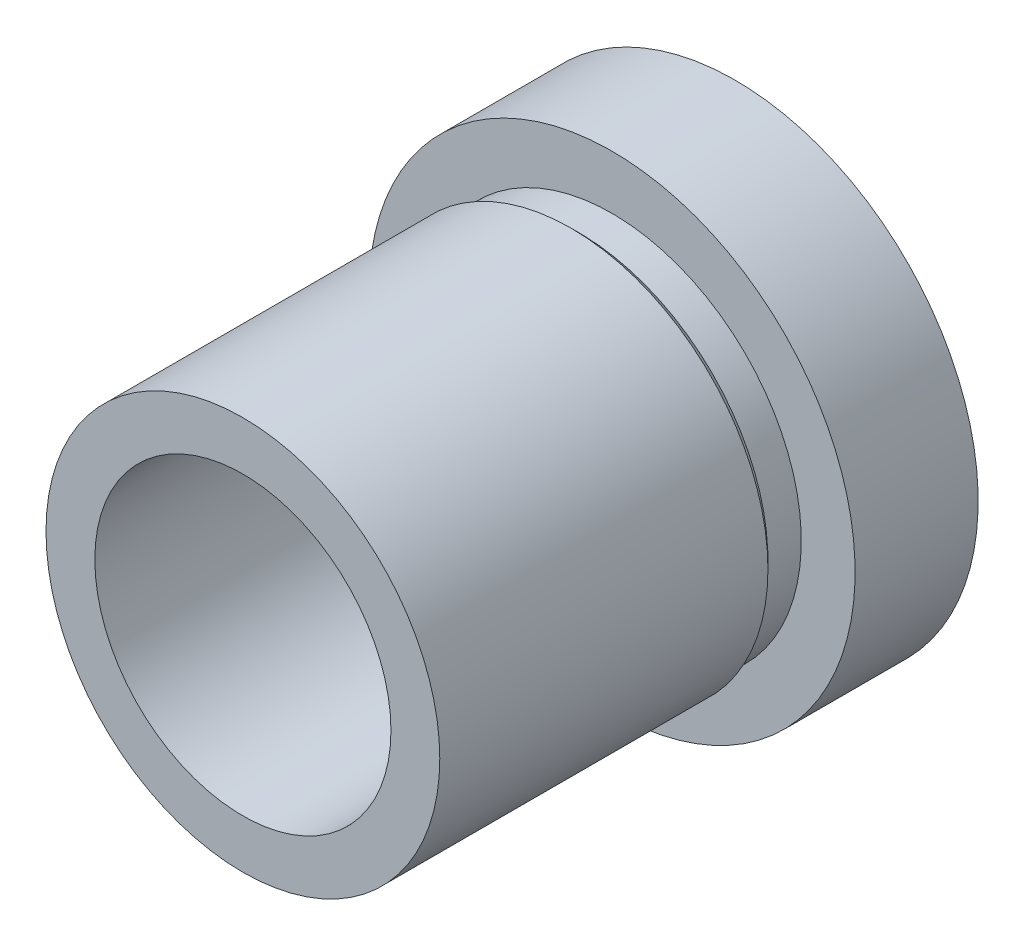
SolidWorks part; units mm, degrees
ref_plane "Front" through (0, 0, 0) normal (0, 0, 1) x (1, 0, 0)
ref_plane "Top" through (0, 0, 0) normal (0, 1, 0) x (1, 0, 0)
ref_plane "Right" through (0, 0, 0) normal (1, 0, 0) x (0, 0, -1)
sketch "Logo3_Revol_Axis" plane through (0, 0, 0) normal (0, 1, 0) x (1, 0, 0)
  line L0 (0, -30.1653) -> (0, 30.1653) construction
sketch "Logo3_bib1" plane through (0, 0, 0) normal (0, -1, 0) x (-1, 0, 0)
  line L1 (9.5504, -23.8125) -> (12.7, -23.8125)
  line L2 (12.7, -23.8125) -> (12.7, -2.6458)
  line L4 (12.2039, 0) -> (12.2039, -2.1497)
  line L5 (12.2039, 0) -> (15.6766, 0)
  line L6 (15.6766, 0) -> (15.6766, 7.9375)
  line L7 (9.7091, 7.9375) -> (9.5504, -20.6375)
  line L8 (9.5504, -20.6375) -> (9.5504, -23.8125)
  line L9 (15.6766, 7.9375) -> (9.7091, 7.9375)
  line L10 (0, 19.4323) -> (0, -23.9633) construction
  line L11 (12.7, -2.6458) -> (12.2039, -2.1497)
  point P11 (9.7091, 7.9375)
revolve "Revolve1" add sketch "Logo3_bib1" angle 360 about L10
other "DeleteFace1"
equation "\"rainure@Logo3_bib1\" = (\"logo3_l1@Logo3_bib1\" -\"logo3_l3@Logo3_bib1\")/3"
equation "\"prof_rainure@Logo3_bib1\" = (\"logo3_d4@Logo3_bib1\"-\"logo3_d3@Logo3_bib1\")/12"
